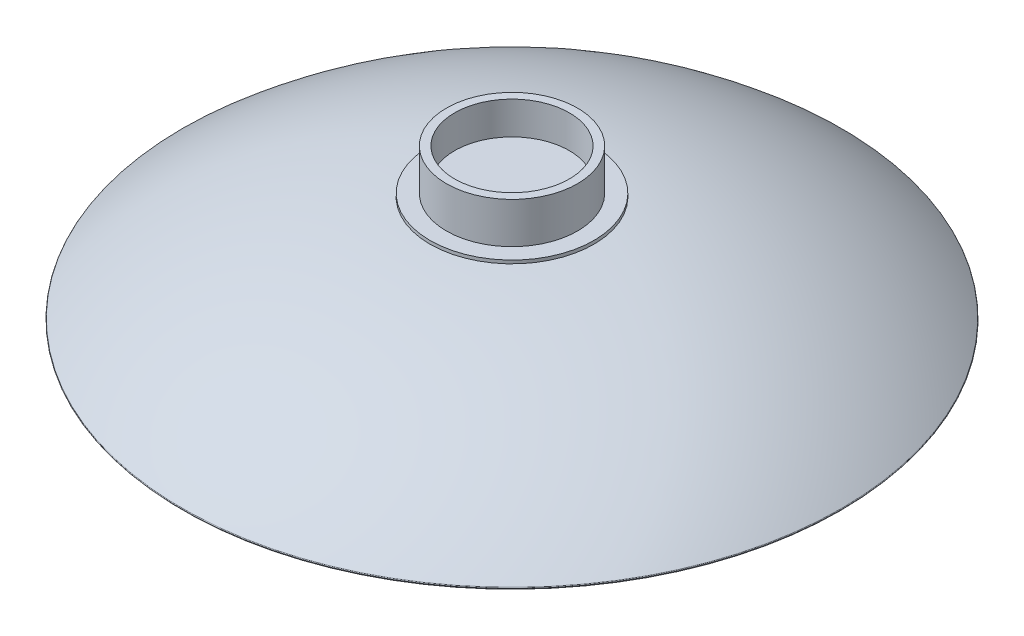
SolidWorks part; units mm, degrees
ref_plane "Alzado" through (0, 0, 0) normal (0, 0, 1) x (1, 0, 0)
ref_plane "Planta" through (0, 0, 0) normal (0, 1, 0) x (1, 0, 0)
ref_plane "Vista lateral" through (0, 0, 0) normal (1, 0, 0) x (0, 0, -1)
sketch "Croquis2" plane through (0, 27, 0) normal (0, -1, 0) x (1, 0, 0)
  circle A0 centre (0, 0) radius 50
  dimension "D1" = 100
extrude "Saliente-Extruir1" add sketch "Croquis2" along normal blind 2 separate body
sketch "Croquis3" plane through (0, 25, 0) normal (0, -1, 0) x (1, 0, 0)
  circle A1 centre (0, 0) radius 50
  circle A2 centre (0, 0) radius 50
  dimension "D1" = 0
extrude "Saliente-Extruir2" add sketch "Croquis3" along normal blind 20 separate body
sketch "Croquis4" plane through (0, 5, 0) normal (0, -1, 0) x (1, 0, 0)
  circle A1 centre (0, 0) radius 50
  circle A2 centre (0, 0) radius 50
  dimension "D1" = 0
extrude "Saliente-Extruir3" add sketch "Croquis4" along normal blind 15 separate body
fillet "Redondeo2" radius 10 1 edges at (0, -10, -50)
sketch "Croquis5" plane through (0, 30, 0) normal (0, 1, 0) x (1, 0, 0)
  circle A0 centre (0, 0) radius 50
  dimension "D1" = 100
extrude "Saliente-Extruir4" add sketch "Croquis5" along normal blind 2 separate body
sketch "Croquis10" plane through (0, 32, 0) normal (0, 1, 0) x (1, 0, 0)
  circle A0 centre (0, 0) radius 40
  dimension "D1" = 80
extrude "Saliente-Extruir8" add sketch "Croquis10" along normal blind 25 separate body
sketch "Croquis11" plane through (0, 0, 0) normal (0, 0, 1) x (1, 0, 0)
  line L4 (0, 27) -> (0, -36) construction
  line L6 (0, -36) -> (200, -36) construction
  line L10 (50, 27) -> (-50, 27) construction
  line L11 (200, -36) -> (201.3066, -34.4858)
  line L12 (0, 27) -> (0, 29.0103)
  arc A4 (0, 27) -> (200, -36) centre (26.878, -236.6334) cw
  arc A5 (0, 29.0103) -> (201.3066, -34.4858) centre (26.878, -236.6334) cw
  arc A6 (-0.2029, 28.9897) -> (201.3066, -34.4858) centre (26.878, -236.6334) cw construction
  dimension "D3" = 265
  dimension "D1" = 63
  dimension "D2" = 200
  dimension "D4" = 2
revolve "Revolución1" add sketch "Croquis11" angle 360 about L4
sketch "Croquis12" plane through (0, 57, 0) normal (0, 1, 0) x (1, 0, 0)
  circle A0 centre (0, 0) radius 35
  dimension "D1" = 70
extrude "Cortar-Extruir1" cut sketch "Croquis12" against normal blind 20
fillet "Redondeo3" radius 0.5 2 edges at (-200, -36, 0) (-201.3066, -34.4858, 0)
